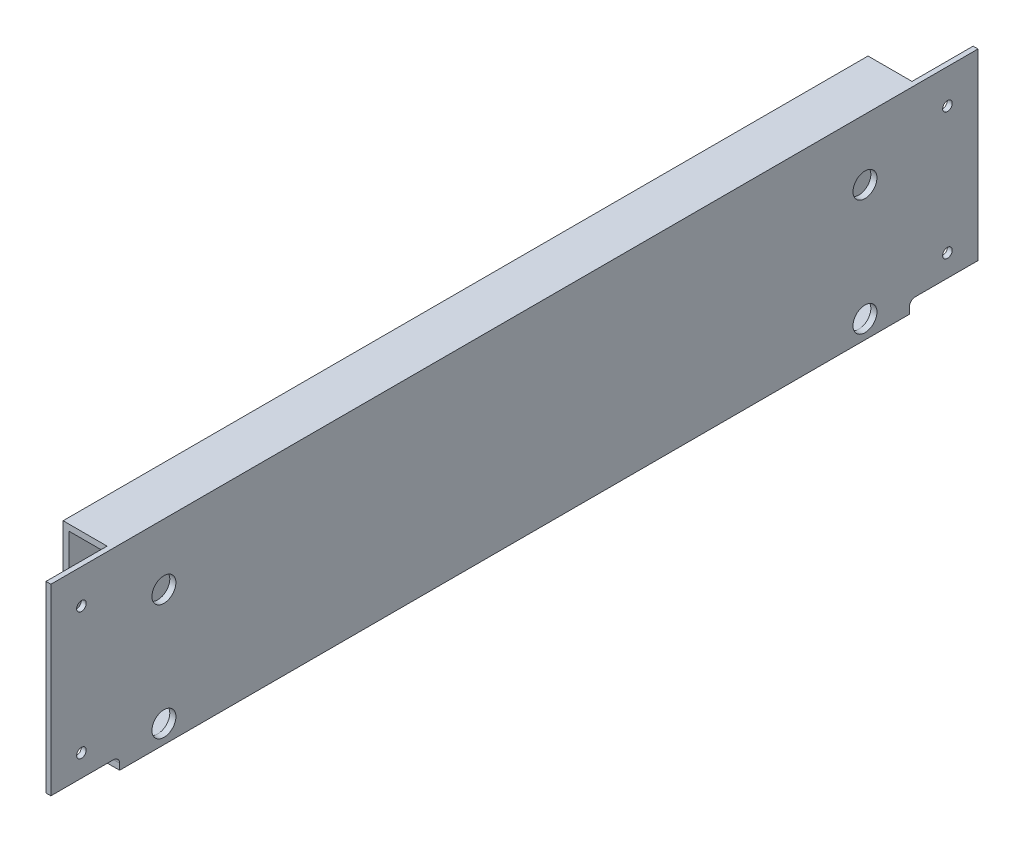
SolidWorks part; units mm, degrees
ref_plane "Front Plane" through (0, 0, 0) normal (0, 0, 1) x (1, 0, 0)
ref_plane "Top Plane" through (0, 0, 0) normal (0, 1, 0) x (1, 0, 0)
ref_plane "Right Plane" through (0, 0, 0) normal (1, 0, 0) x (0, 0, -1)
sketch "Sketch1" plane through (0, 0, 0) normal (0, 0, 1) x (1, 0, 0)
  line L0 (-12.7, 50.8) -> (12.7, -50.8) construction
  line L1 (-12.7, 50.8) -> (12.7, 50.8)
  line L2 (-12.7, 50.8) -> (-12.7, -50.8)
  line L3 (-12.7, -50.8) -> (12.7, -50.8)
  line L4 (12.7, 50.8) -> (12.7, -50.8)
  point P4 (0, 0)
  dimension "D1" = 25.4
  dimension "D2" = 101.6
extrude "Extrude-Thin1" add sketch "Sketch1" along normal mid plane 481.75 thin
sketch "Sketch2" plane through (-12.7, 0, 0) normal (-1, 0, 0) x (0, 0, 1)
  line L0 (240.875, 50.8) -> (-240.875, 50.8) construction
  line L1 (209.125, 50.8) -> (240.875, 50.8)
  line L2 (209.125, 50.8) -> (209.125, -50.8)
  line L3 (209.125, -50.8) -> (240.875, -50.8)
  line L4 (240.875, 50.8) -> (240.875, -50.8)
  dimension "D1" = 31.75
extrude "Cut-Extrude1" cut sketch "Sketch2" against normal offset from surface (22.86 mm away) 2.54
sketch "Sketch3" plane through (-12.7, 0, 0) normal (-1, 0, 0) x (0, 0, 1)
  line L1 (240.875, -44.45) -> (205.1562, -44.45)
  line L2 (240.875, -44.45) -> (240.875, -50.8)
  line L3 (240.875, -50.8) -> (205.1562, -50.8)
  line L4 (205.1562, -44.45) -> (205.1562, -50.8)
  line L5 (240.875, 50.8) -> (240.875, -50.8) construction
  dimension "D1" = 6.35
  dimension "D2" = 35.7188
extrude "Cut-Extrude2" cut sketch "Sketch3" against normal through all
sketch "Sketch4" plane through (10.16, 0, 0) normal (-1, 0, 0) x (0, 0, 1)
  line L0 (0, 0) -> (92.727, 0) construction
  line L1 (225, 44.45) -> (225, 33.02) construction
  line L3 (240.875, -44.45) -> (209.125, -44.45) construction
  point P7 (225, -44.45)
  dimension "D1" = 33.02
hole_wizard "#10 Clearance Hole1" positions "Sketch6" profile "Sketch5" hole size "#10" standard "Ansi Inch"
sketch "Sketch6" plane through (10.16, 0, 0) normal (-1, 0, 0) x (0, 0, 1)
  point P0 (225, 33.02)
sketch "Sketch5" plane through (10.16, 33.02, 225) normal (0, 1, 0) x (0, 0, 1)
  line L0 (0, 0) -> (0, 2.54)
  line L1 (0, 2.54) -> (2.4892, 2.54)
  line L2 (2.4892, 2.54) -> (2.4892, 0)
  line L5 (2.4892, 0) -> (0, 0)
  line L11 (0, -6.35) -> (0, 107.95) construction
  dimension "Thru Hole Dia." = 4.9784
  dimension "Thru Hole Depth" = 2.54
mirror "Mirror1" about plane through (0, 0, 0) normal (0, 1, 0) of "#10 Clearance Hole1"
mirror "Mirror2" about plane through (0, 0, 0) normal (0, 0, 1) of "Cut-Extrude1", "Cut-Extrude2", "Mirror1", "#10 Clearance Hole1"
fillet "Fillet1" radius 3.175 4 edges at (11.1125, -44.45, 205.1562) (-11.1125, -44.45, 205.1562) (-11.1125, -44.45, -205.1562) (11.1125, -44.45, -205.1562)
sketch "Sketch7" plane through (9.525, 0, 0) normal (-1, 0, 0) x (0, 0, 1)
  line L0 (182.1375, -41.275) -> (127.8328, -41.275) construction
  line L1 (182.1375, -41.275) -> (182.1375, 19.05) construction
  line L2 (209.125, 47.625) -> (209.125, -44.45) construction
  line L3 (205.1562, -50.8) -> (-205.1562, -50.8) construction
  line L4 (209.125, 50.8) -> (-209.125, 50.8) construction
  circle A0 centre (182.1375, -41.275) radius 6.223
  circle A1 centre (182.1375, 19.05) radius 6.223
  dimension "D3" = 12.446
  dimension "D1" = 26.9875
  dimension "D2" = 9.525
  dimension "D4" = 31.75
extrude "Cut-Extrude3" cut sketch "Sketch7" against normal up to next
hole_wizard "1/4 Clearance Hole1" positions "Sketch9" profile "Sketch8" hole size "1/4" standard "Ansi Inch"
sketch "Sketch9" plane through (-12.7, 25.3344, -55.0281) normal (-1, 0, 0) x (0, 0, 1)
  circle A0 centre (237.1656, -6.2844) radius 6.223 construction
  point P0 (237.1656, -6.2844)
  point P1 (237.1656, -66.6094)
sketch "Sketch8" plane through (-12.7, 19.05, 182.1375) normal (0, 1, 0) x (0, 0, 1)
  line L0 (0, 0) -> (0, 3.175)
  line L1 (0, 3.175) -> (3.8989, 3.175)
  line L2 (3.2639, 2.54) -> (3.2639, 0.635)
  line L3 (3.2639, 0.635) -> (3.8989, 0)
  line L5 (3.8989, 0) -> (0, 0)
  line L6 (-3.2639, 0.635) -> (-3.8989, 0) construction
  line L7 (3.8989, 3.175) -> (3.2639, 2.54)
  line L8 (-3.8989, 3.175) -> (-3.2639, 2.54) construction
  line L11 (0, -6.35) -> (0, 107.95) construction
  dimension "Thru Hole Dia." = 6.5278
  dimension "Thru Hole Depth" = 3.175
  dimension "Near C'Sink Dia." = 7.7978
  dimension "Near C'Sink Angle" = 90
  dimension "Far C'Sink Dia." = 7.7978
  dimension "Far C'Sink Angle" = 90
mirror "Mirror3" about plane through (0, 0, 0) normal (0, 0, 1) of "Cut-Extrude3", "1/4 Clearance Hole1"
